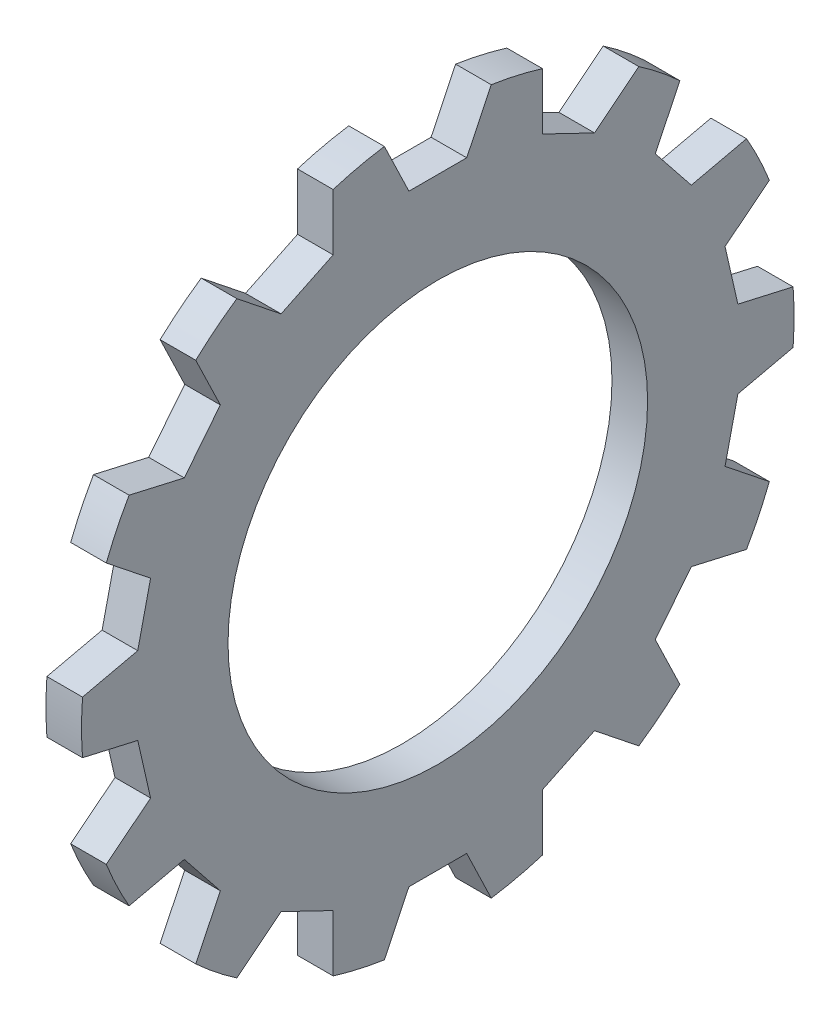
SolidWorks part; units mm, degrees
ref_plane "Plane1" through (0, 0, 0) normal (0, 0, 1) x (1, 0, 0)
ref_plane "Plane2" through (0, 0, 0) normal (0, 1, 0) x (1, 0, 0)
ref_plane "Plane3" through (0, 0, 0) normal (1, 0, 0) x (0, 0, -1)
sketch "Sketch1" plane through (0, 0, 0) normal (1, 0, 0) x (0, 0, -1)
  circle A0 centre (0, 0) radius 6.731
  circle A1 centre (0, 0) radius 11.43
  dimension "InsideDia" = 13.462
  dimension "OutsideDia" = 22.86
extrude "Base-Extrude" add sketch "Sketch1" against normal blind 1.143
sketch "Sketch3" plane through (0, 0, 0) normal (1, 0, 0) x (0, 0, -1)
  line L0 (0.9271, 9.6633) -> (1.7145, 11.3007)
  line L1 (-0.9271, 9.6633) -> (-1.7145, 11.3007)
  line L2 (-1.7145, 11.3007) -> (-1.7145, 12.3294)
  line L3 (-1.7145, 12.3294) -> (1.7145, 12.3294)
  line L4 (1.7145, 12.3294) -> (1.7145, 11.3007)
  line L5 (-0.9271, 9.6633) -> (0.9271, 9.6633)
  arc A0 (-0.9271, 9.6633) -> (0.9271, 9.6633) centre (0, 10.1092) ccw construction
  circle A1 centre (0, 0) radius 11.43 construction
  circle A2 centre (0, 0) radius 9.0805 construction
  dimension "D1" = 2.0574
  dimension "D4" = 18.161
  dimension "D2" = 3.429
  dimension "D3" = 1.0287
  dimension "D5" = 1.7145
extrude "TypeASlot" cut sketch "Sketch3" against normal through all
pattern_circular "TypeAPattern" count 14 over 360 about axis through (0, 0, 0) along (1, 0, 0) of "TypeASlot"
equation "\"D1@Sketch3\" = \"OutsideDia@Sketch1\" * .09"
equation "\"D2@Sketch3\" = \"OutsideDia@Sketch1\" * .15"
equation "\"D3@Sketch3\" = \"D1@Sketch3\" / 2"
equation "\"D4@Sketch3\" = \"InsideDia@Sketch1\" +  ( \"OutsideDia@Sketch1\" - \"InsideDia@Sketch1\" )  / 2"
equation "\"D5@Sketch3\" = \"D2@Sketch3\" / 2"
